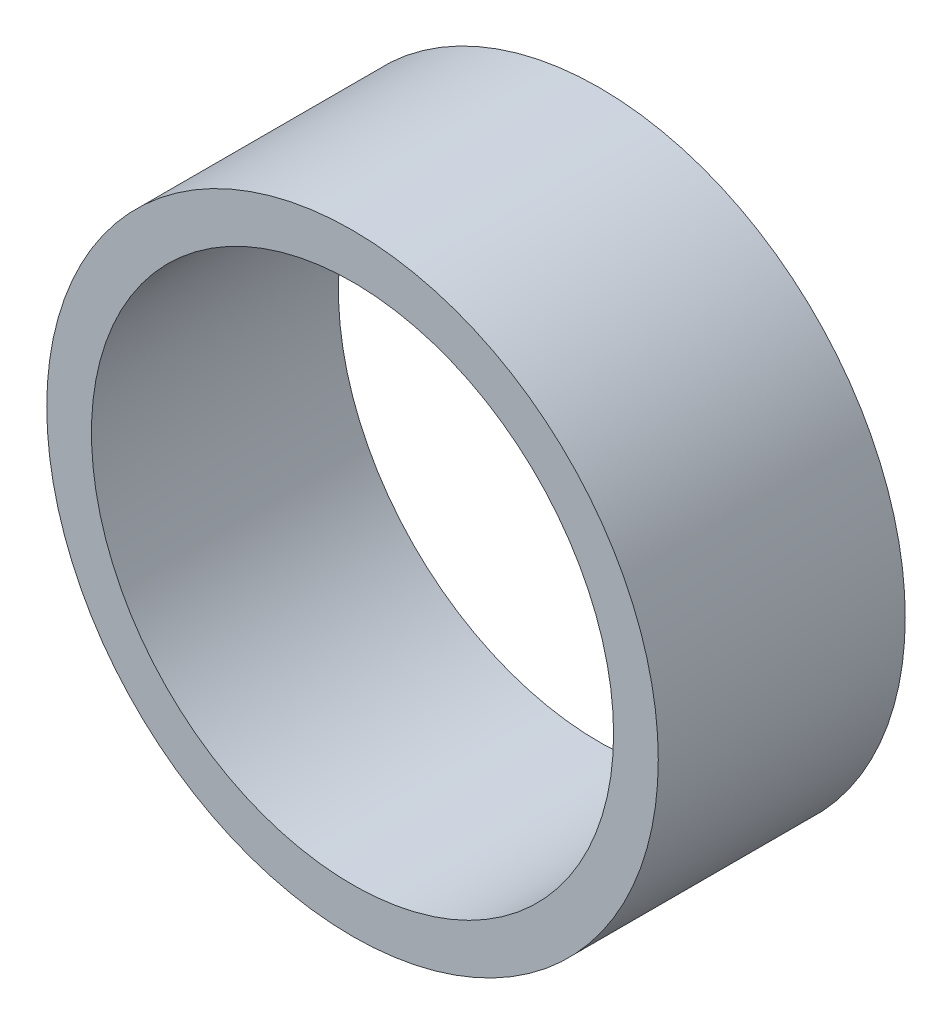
SolidWorks part; units mm, degrees
ref_plane "正面" through (0, 0, 0) normal (0, 0, 1) x (1, 0, 0)
ref_plane "平面" through (0, 0, 0) normal (0, 1, 0) x (1, 0, 0)
ref_plane "右側面" through (0, 0, 0) normal (1, 0, 0) x (0, 0, -1)
sketch "ｽｹｯﾁ1" plane through (0, 0, 0) normal (0, 0, 1) x (1, 0, 0)
  circle A0 centre (0, 0) radius 13
  dimension "D1" = 26
extrude "ﾎﾞｽ - 押し出し1" add sketch "ｽｹｯﾁ1" against normal blind 10.5
sketch "ｽｹｯﾁ2" plane through (0, 0, 0) normal (0, 0, 1) x (1, 0, 0)
  circle A0 centre (0, 0) radius 11.1
  dimension "D1" = 22.2
extrude "ｶｯﾄ - 押し出し1" cut sketch "ｽｹｯﾁ2" against normal through all
